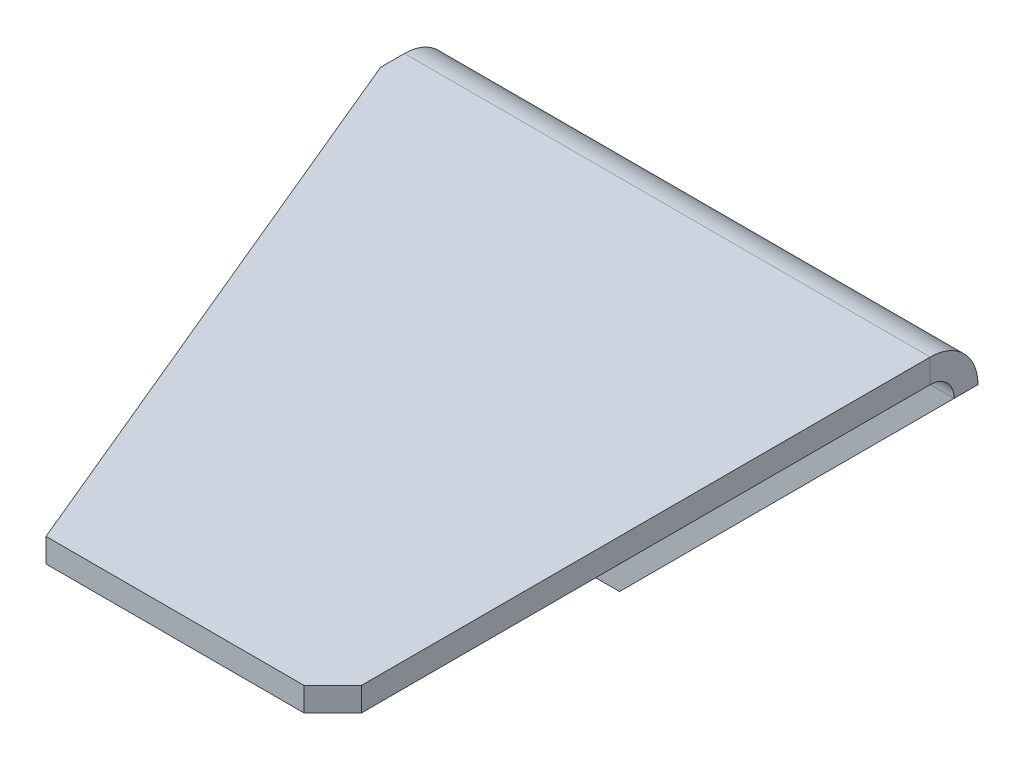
SolidWorks part; units mm, degrees
ref_plane "Plan de face" through (0, 0, 0) normal (0, 0, 1) x (1, 0, 0)
ref_plane "Plan de dessus" through (0, 0, 0) normal (0, 1, 0) x (1, 0, 0)
ref_plane "Plan de droite" through (0, 0, 0) normal (1, 0, 0) x (0, 0, -1)
mirrored part "CD033074_Rendre symétrique"
other "<CD033074>-<Coin-brisé2>"
